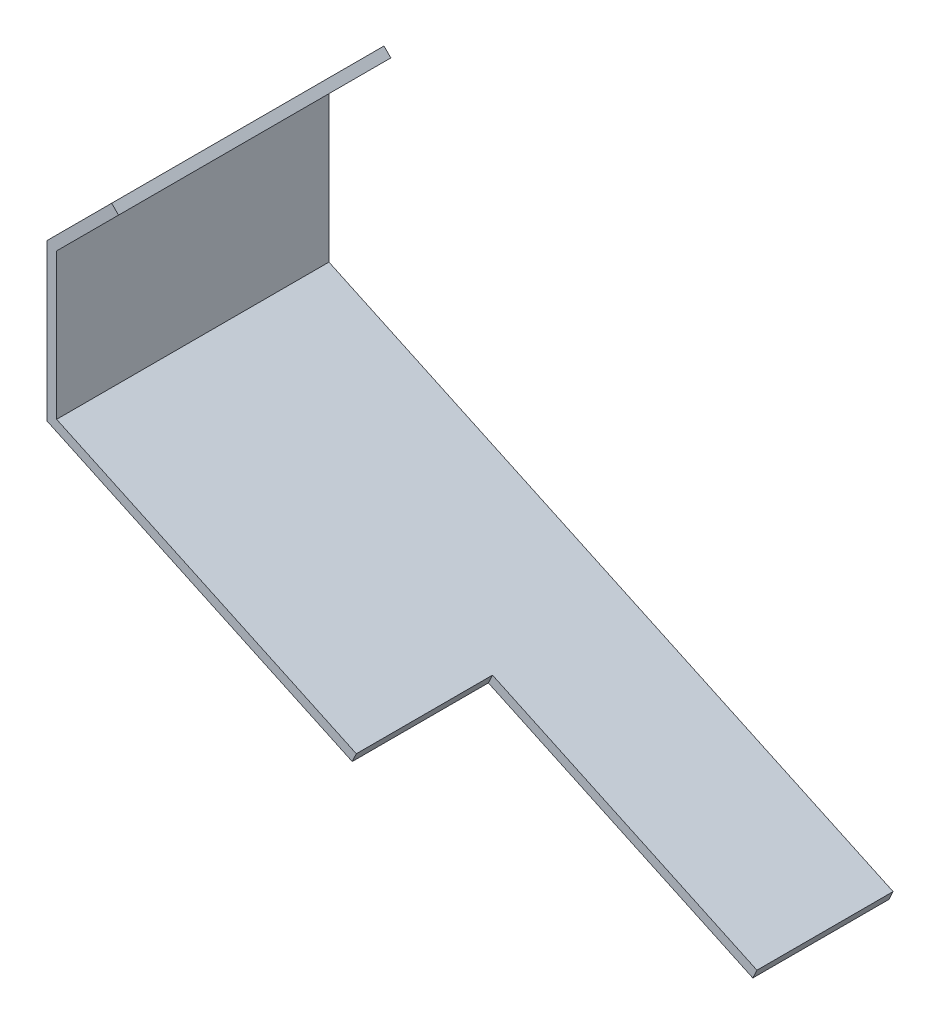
SolidWorks part; units mm, degrees
ref_plane "Plan de face" through (0, 0, 0) normal (0, 0, 1) x (1, 0, 0)
ref_plane "Plan de dessus" through (0, 0, 0) normal (0, 1, 0) x (1, 0, 0)
ref_plane "Plan de droite" through (0, 0, 0) normal (1, 0, 0) x (0, 0, -1)
sketch "Esquisse1" plane through (0, 0, 0) normal (0, 0, 1) x (1, 0, 0)
  line L0 (0, 0) -> (0, 75)
  line L1 (0, 75) -> (31.8198, 106.8198)
  line L2 (0, 0) -> (290.0185, -135.2378)
  dimension "D1" = 75
  dimension "D2" = 45
  dimension "D3" = 45
  dimension "D4" = 115
  dimension "D5" = 320
extrude "Extru.-Mince1" add sketch "Esquisse1" along normal mid plane 140 thin
sketch "Esquisse5" plane through (-2.1131, -4.5315, 0) normal (-0.4226, -0.9063, 0) x (0.9063, -0.4226, 0)
  line L1 (320, 70) -> (170, 70)
  line L2 (320, 70) -> (320, 0)
  line L3 (320, 0) -> (170, 0)
  line L4 (170, 70) -> (170, 0)
  dimension "D1" = 70
  dimension "D2" = 150
extrude "Enlèv. mat.-Extru.1" cut sketch "Esquisse5" against normal blind 10
